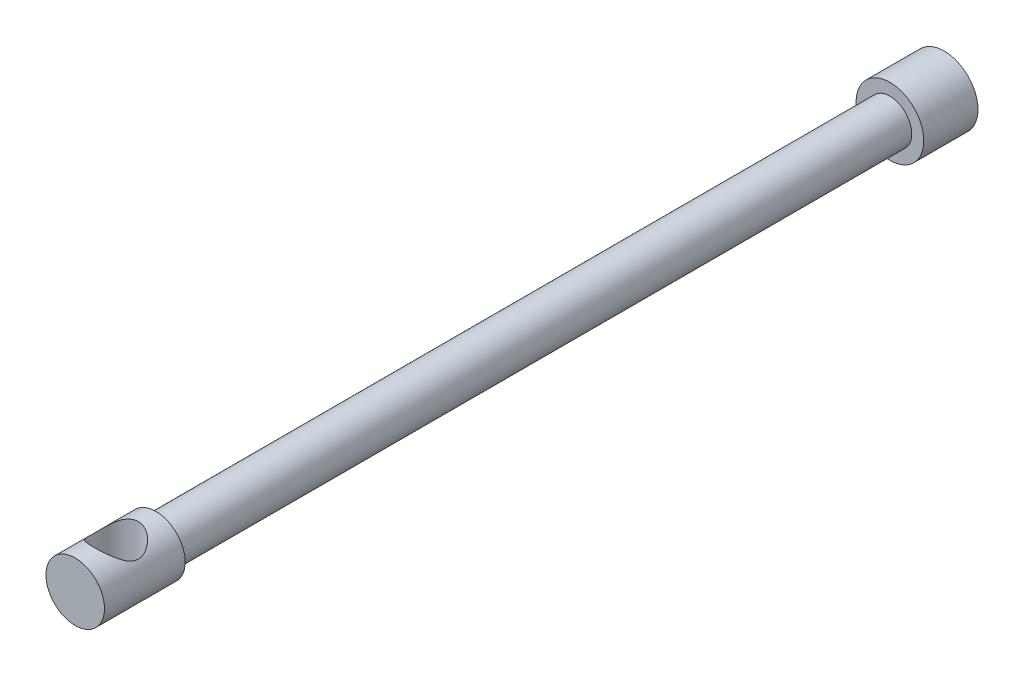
SolidWorks part; units mm, degrees
ref_plane "Front" through (0, 0, 0) normal (0, 0, 1) x (1, 0, 0)
ref_plane "Top" through (0, 0, 0) normal (0, 1, 0) x (1, 0, 0)
ref_plane "Right" through (0, 0, 0) normal (1, 0, 0) x (0, 0, -1)
sketch "Sketch1" plane through (0, 0, 0) normal (0, 0, 1) x (1, 0, 0)
  circle A0 centre (0, 0) radius 3.6385
  dimension "D1" = 7.2771
extrude "Extrude1" add sketch "Sketch1" along normal blind 5.842
sketch "Sketch2" plane through (0, 0, 0) normal (0, 0, 1) x (1, 0, 0)
  circle A0 centre (0, 0) radius 2.3495
  dimension "D1" = 4.699
extrude "Extrude2" add sketch "Sketch2" along normal blind 84.8614
sketch "Sketch5" [suppressed] plane through (0, 0, 84.8614) normal (0, 0, 1) x (1, 0, 0)
  circle A0 centre (0, 0) radius 1.9558
  dimension "D1" = 3.9116
extrude "Cut-Extrude2" [suppressed] cut sketch "Sketch5" against normal blind 2.2352
hole_wizard "#6-40 Tapped Hole1" positions "Sketch7" profile "Sketch6" tap size "#6-40" standard "Ansi Inch"
sketch "Sketch7" plane through (0, 0, 82.6262) normal (0, 0, 1) x (1, 0, 0)
  point P0 (0, 0)
sketch "Sketch6" plane through (0, 0, 82.6262) normal (1, 0, 0) x (0, -1, 0)
  line L0 (0, 0) -> (0, 9.7777)
  line L1 (0, 9.7777) -> (1.4351, 8.9154)
  line L2 (1.4351, 8.9154) -> (1.4351, 0)
  line L5 (1.4351, 0) -> (0, 0)
  line L10 (0, 9.7777) -> (-1.4351, 8.9154) construction
  line L11 (0, -6.35) -> (0, 107.95) construction
  dimension "Tap Drill Dia." = 2.8702
  dimension "Tap Drill Depth" = 8.9154
  dimension "Drill Angle" = 118
sketch "Sketch3" plane through (0, 0, 84.8614) normal (0, 0, 1) x (1, 0, 0)
  circle A0 centre (0, 0) radius 3.1496
  circle A1 centre (0, 0) radius 2.3495 construction
  dimension "D1" = 6.2992
extrude "Extrude3" add sketch "Sketch3" along normal blind 8.6868
sketch "Sketch4" plane through (0, 0, 0) normal (0, 1, 0) x (1, 0, 0)
  circle A0 centre (0, -89.154) radius 2.4003
  dimension "D2" = 4.8006
  dimension "D1" = 89.154
extrude "Cut-Extrude1" cut sketch "Sketch4" against normal through all and the other way through all
